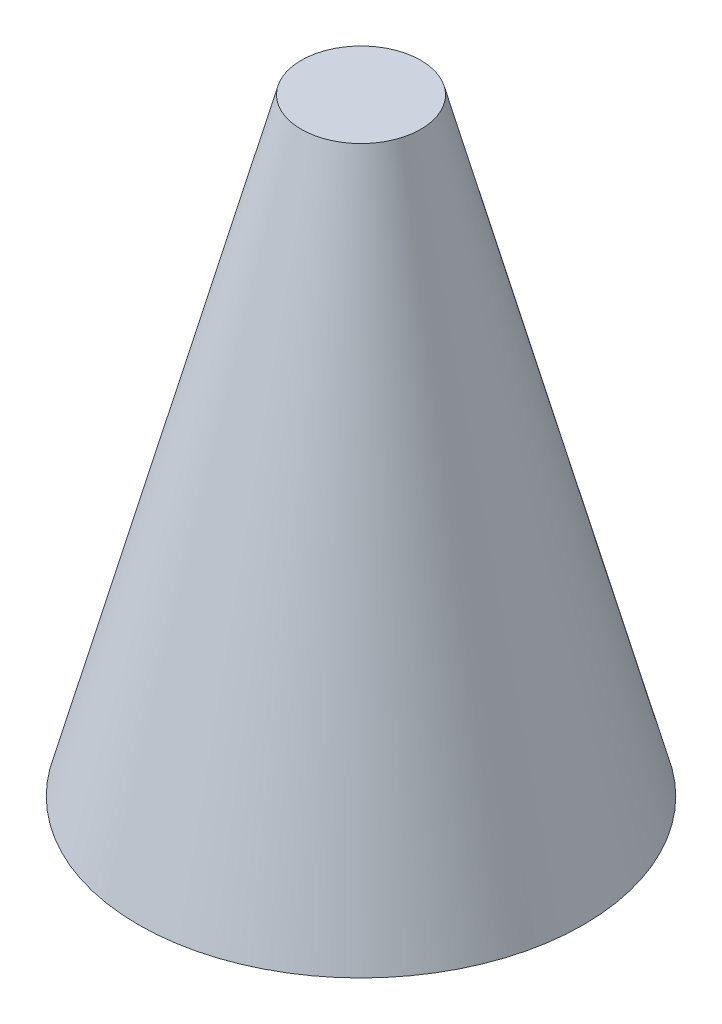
SolidWorks part; units mm, degrees
ref_plane "Front Plane" through (0, 0, 0) normal (0, 0, 1) x (1, 0, 0)
ref_plane "Top Plane" through (0, 0, 0) normal (0, 1, 0) x (1, 0, 0)
ref_plane "Right Plane" through (0, 0, 0) normal (1, 0, 0) x (0, 0, -1)
sketch "Sketch1" plane through (0, 0, 0) normal (0, 0, 1) x (1, 0, 0)
  line L0 (0, 0) -> (-37.5, 0)
  line L1 (-37.5, 0) -> (-139.5886, -381)
  line L2 (-139.5886, -381) -> (0, -381)
  line L3 (0, -381) -> (0, 0)
  line L4 (-37.5, 0) -> (-37.5, -131.3772) construction
  dimension "D1" = 15
  dimension "D2" = 37.5
  dimension "D3" = 381
revolve "Revolve1" add sketch "Sketch1" angle 360 about L3
sketch "Sketch2" plane through (0, 0, 0) normal (0, 0, 1) x (1, 0, 0)
  line L0 (0, -381) -> (-63.3886, -381)
  line L1 (-139.5886, -381) -> (139.5886, -381) construction
  line L2 (-63.3886, -381) -> (0, -65.3082)
  line L4 (0, -65.3082) -> (0, -381)
  dimension "D1" = 76.2
revolve "Cut-Revolve1" cut sketch "Sketch2" angle 360 about L4
